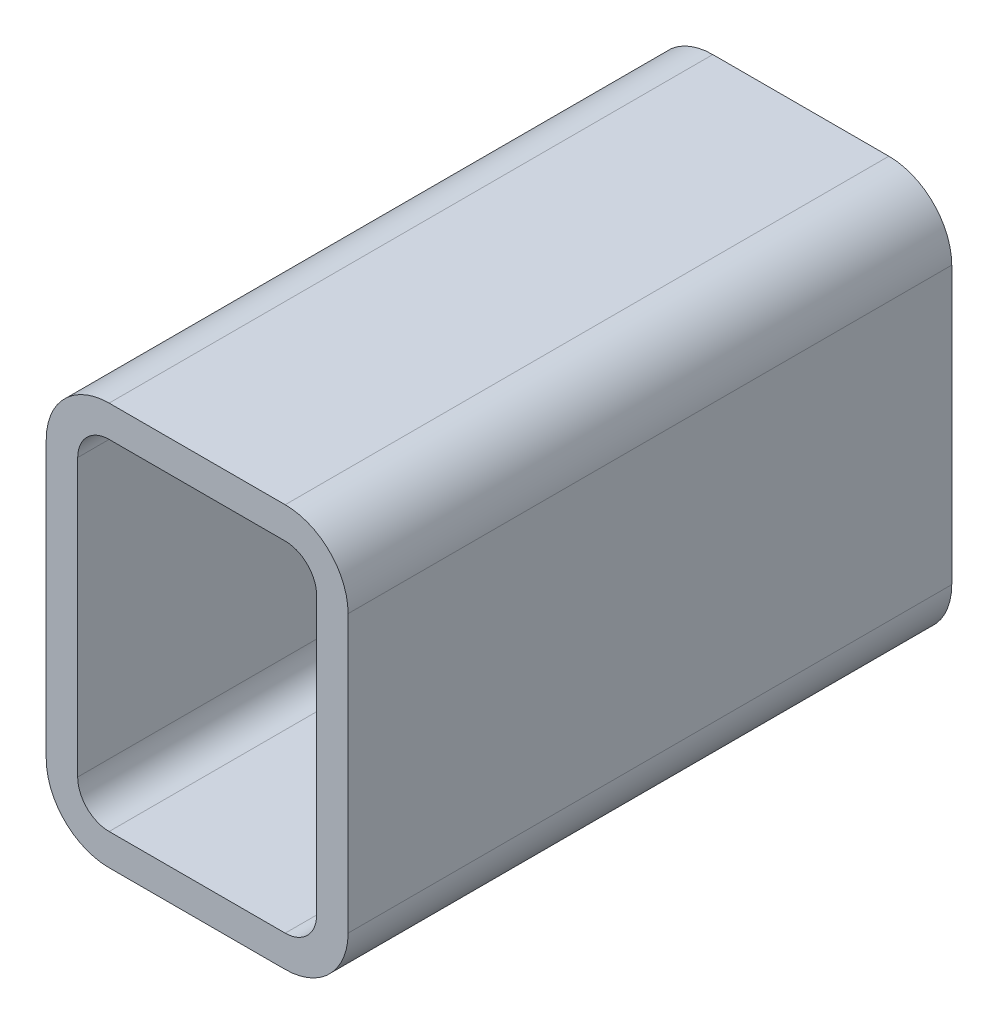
SolidWorks part; units mm, degrees
ref_plane "Front Plane" through (0, 0, 0) normal (0, 0, 1) x (1, 0, 0)
ref_plane "Top Plane" through (0, 0, 0) normal (0, 1, 0) x (1, 0, 0)
ref_plane "Right Plane" through (0, 0, 0) normal (1, 0, 0) x (0, 0, -1)
sketch "Sketch1" plane through (0, 0, 0) normal (0, 0, 1) x (1, 0, 0)
sketch_block_instance "HSS8x6x0.625-1"
sketch_block "HSS8x6x0.625"
extrude "Boss-Extrude1" add sketch "Sketch1" along normal blind 304.8
